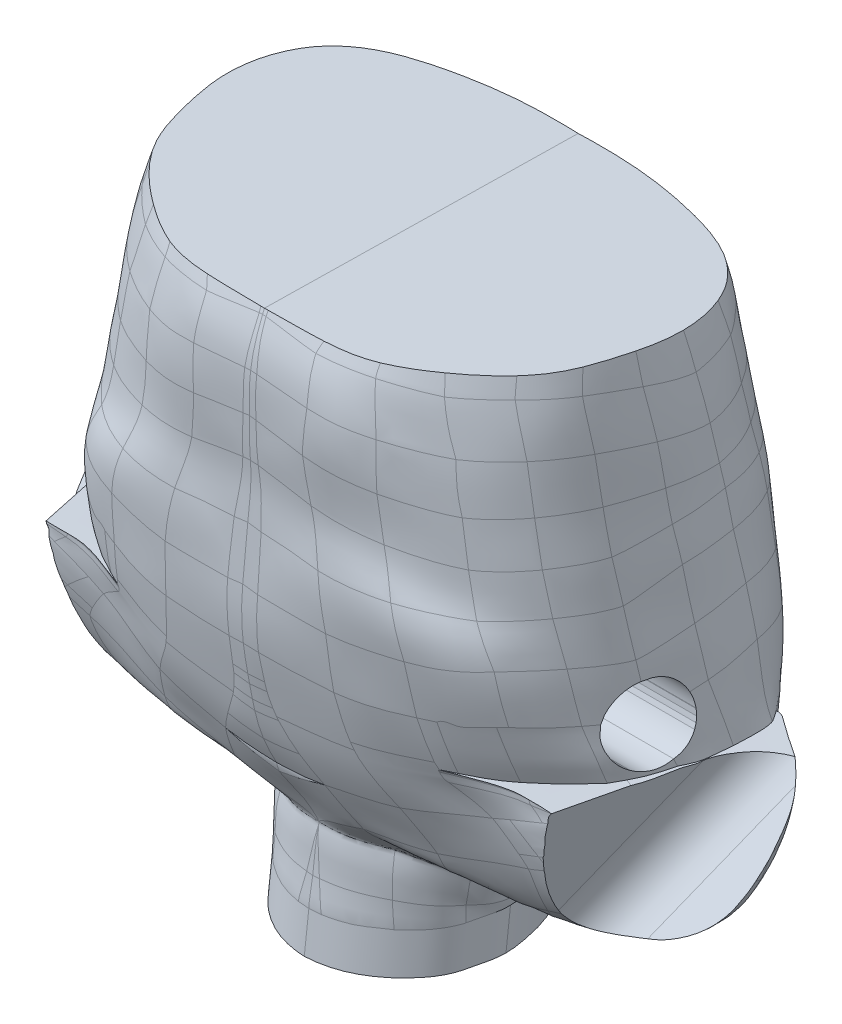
SolidWorks part; units mm, degrees
ref_plane "Front Plane" through (0, 0, 0) normal (0, 0, 1) x (1, 0, 0)
ref_plane "Top Plane" through (0, 0, 0) normal (0, 1, 0) x (1, 0, 0)
ref_plane "Right Plane" through (0, 0, 0) normal (1, 0, 0) x (0, 0, -1)
imported_body "Surface-Imported1"
imported_body "Surface-Imported2"
imported_body "Surface-Imported3"
imported_body "Surface-Imported4"
surface "Surface-Knit1"
